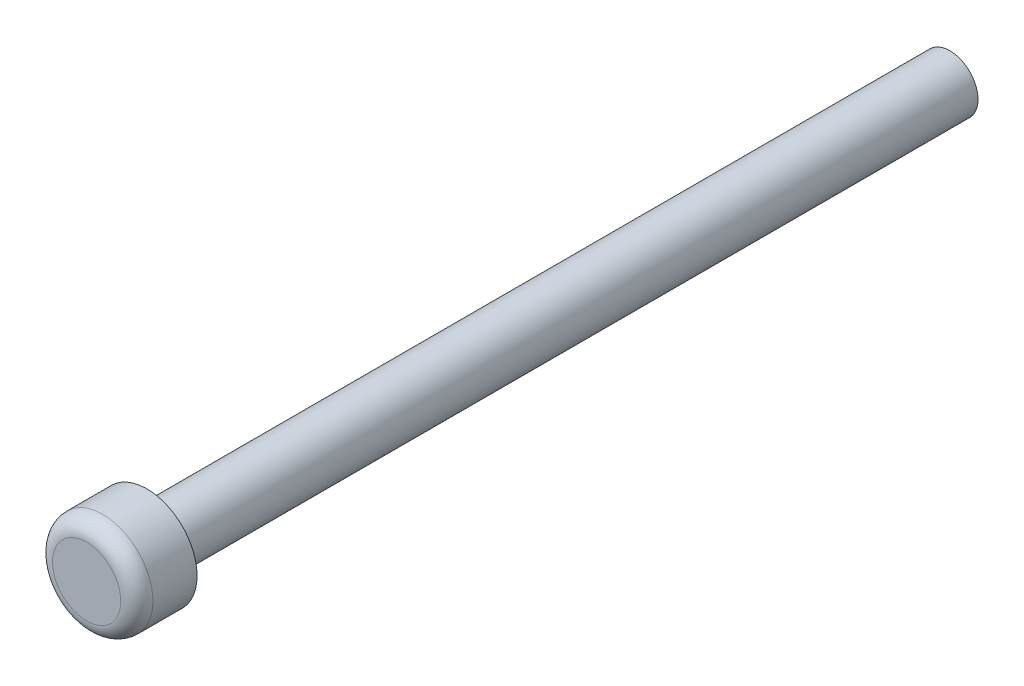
SolidWorks part; units mm, degrees
ref_plane "Front Plane" through (0, 0, 0) normal (0, 0, 1) x (1, 0, 0)
ref_plane "Top Plane" through (0, 0, 0) normal (0, 1, 0) x (1, 0, 0)
ref_plane "Right Plane" through (0, 0, 0) normal (1, 0, 0) x (0, 0, -1)
sketch "Sketch1" plane through (0, 0, 0) normal (0, 0, 1) x (1, 0, 0)
  circle A0 centre (212.5, 139) radius 7 construction
  circle A1 centre (212.5, 139) radius 7
extrude "Boss-Extrude1" add sketch "Sketch1" along normal blind 80 and the other way blind 120
sketch "Sketch2" plane through (0, 0, 80) normal (0, 0, 1) x (1, 0, 0)
  circle A0 centre (212.5, 139) radius 12.5
  dimension "D1" = 25
extrude "Boss-Extrude2" add sketch "Sketch2" along normal blind 15
fillet "Fillet1" radius 4 1 edges at (225, 139, 95)
